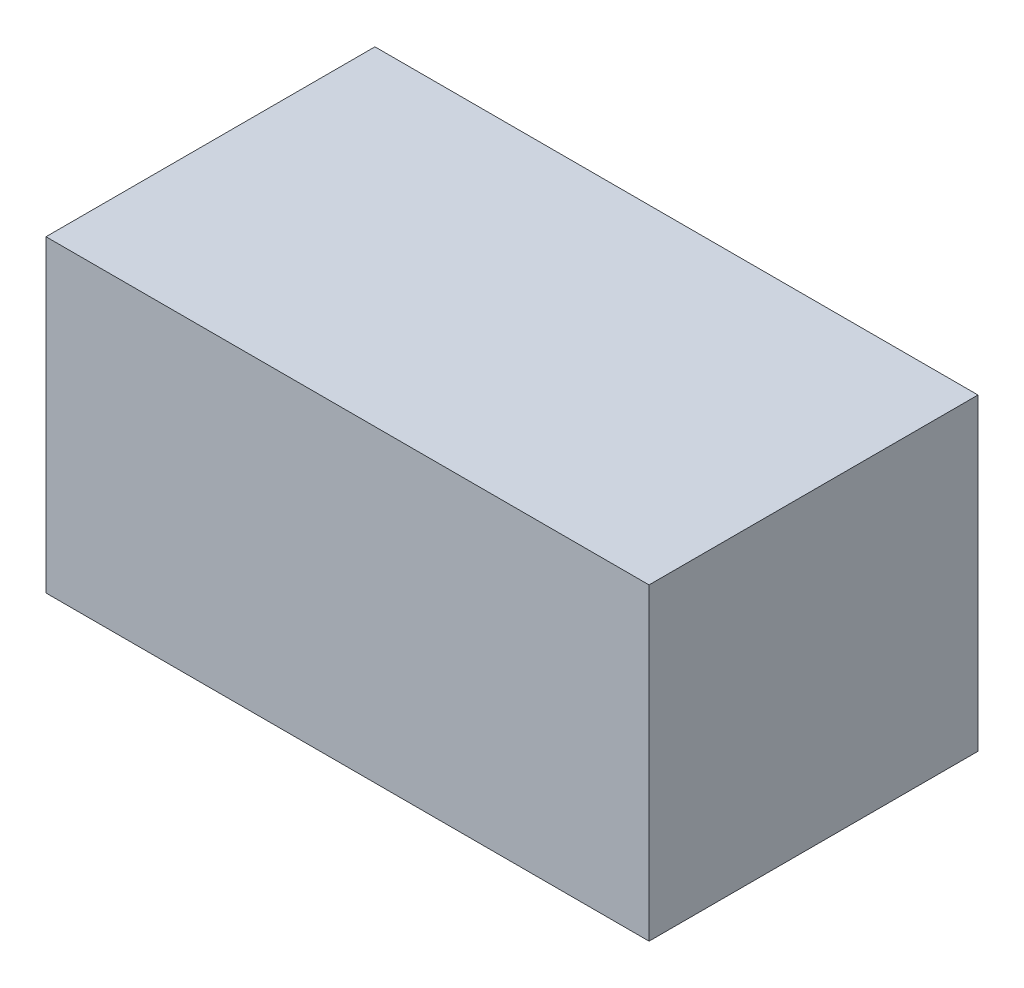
SolidWorks part; units mm, degrees
ref_plane "Front" through (0, 0, 0) normal (0, 0, 1) x (1, 0, 0)
ref_plane "Top" through (0, 0, 0) normal (0, 1, 0) x (1, 0, 0)
ref_plane "Right" through (0, 0, 0) normal (1, 0, 0) x (0, 0, -1)
sketch "Sketch1" plane through (0, 0, 0) normal (0, 0, 1) x (1, 0, 0)
  line L1 (55, 0) -> (-55, 0)
  line L2 (-55, 0) -> (-55, 56.2831)
  line L3 (55, 0) -> (55, 56.2831)
  line L4 (-55, 56.2831) -> (55, 56.2831)
  dimension "D1" = 56.2831
  dimension "D3" = 110
extrude "Extrude1" add sketch "Sketch1" along normal mid plane 60
